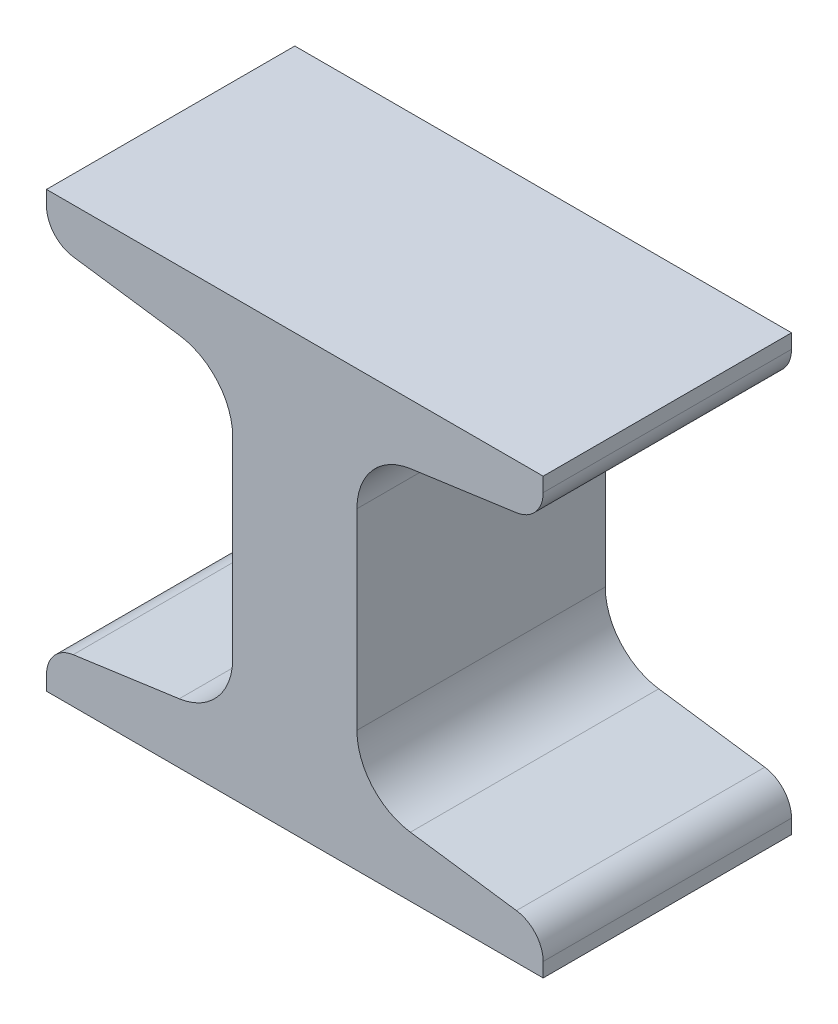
SolidWorks part; units mm, degrees
ref_plane "Plane1" through (0, 0, 0) normal (0, 0, 1) x (1, 0, 0)
ref_plane "Plane2" through (0, 0, 0) normal (0, 1, 0) x (-1, 0, 0)
ref_plane "Plane3" through (0, 0, 0) normal (1, 0, 0) x (0, 0, -1)
sketch "Sketch1" plane through (0, 0, 0) normal (0, 0, 1) x (1, 0, 0)
  line L0 (0, 0) -> (0, 4.2221)
  line L1 (0, 4.2221) -> (13.5803, 6.1232)
  line L2 (19.05, 12.4119) -> (19.05, 32.0381)
  line L3 (13.5803, 38.3268) -> (0, 40.2279)
  line L4 (0, 40.2279) -> (0, 44.45)
  line L5 (0, 44.45) -> (50.8, 44.45)
  line L6 (50.8, 44.45) -> (50.8, 40.2279)
  line L7 (50.8, 40.2279) -> (37.2197, 38.3268)
  line L8 (31.75, 32.0381) -> (31.75, 12.4119)
  line L9 (37.2197, 6.1232) -> (50.8, 4.2221)
  line L10 (50.8, 4.2221) -> (50.8, 0)
  line L11 (50.8, 0) -> (0, 0)
  line L12 (15.6984, 0) -> (-15.6984, 0) construction
  line L13 (0, -13.7361) -> (0, 13.7361) construction
  line L15 (12.7, 67.0228) -> (12.7, -15.5272) construction
  line L16 (-1025.4, 6) -> (48974.6, 6) construction
  arc A0 (13.5803, 6.1232) -> (19.05, 12.4119) centre (12.7, 12.4119) ccw
  arc A1 (19.05, 32.0381) -> (13.5803, 38.3268) centre (12.7, 32.0381) ccw
  arc A2 (37.2197, 38.3268) -> (31.75, 32.0381) centre (38.1, 32.0381) ccw
  arc A3 (31.75, 12.4119) -> (37.2197, 6.1232) centre (38.1, 12.4119) ccw
  point P18 (12.7, 6)
  dimension "RI" = 6.35
  dimension "BF" = 50.8
  dimension "D2" = 97.969
  dimension "DEPTH" = 44.45
  dimension "TW" = 12.7
  dimension "D1" = 12.7
  dimension "TF" = 6
extrude "BaseSbeam" add sketch "Sketch1" along normal mid plane 25.4
fillet "ToeFillet" radius 3.175 4 edges at (50.8, 4.2221, 0) (0, 4.2221, 0) (50.8, 40.2279, 0) (0, 40.2279, 0)
equation "\"D1@Sketch1\" =\"BF@Sketch1\" / 4"
